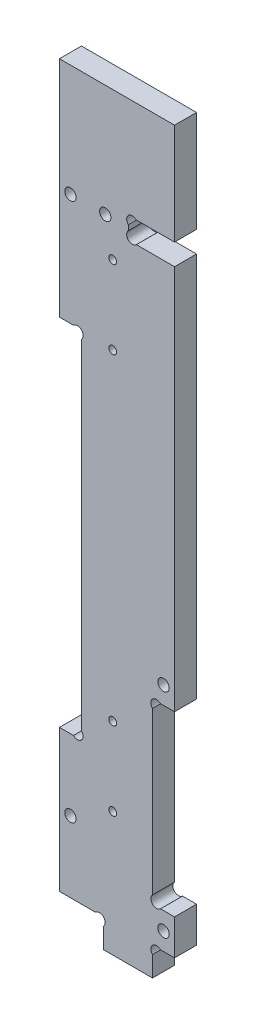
SolidWorks part; units mm, degrees
ref_plane "Face" through (0, 0, 0) normal (0, 0, 1) x (1, 0, 0)
ref_plane "Dessus" through (0, 0, 0) normal (0, 1, 0) x (1, 0, 0)
ref_plane "Droite" through (0, 0, 0) normal (1, 0, 0) x (0, 0, -1)
sketch "Esquisse1" plane through (0, 0, 0) normal (0, 0, 1) x (1, 0, 0)
  line L0 (6.2, 50) -> (-11.8335, 68.0335) construction
  line L1 (11.2604, 30) -> (-9.448, 30) construction
  line L2 (0, 150) -> (0, 213)
  line L3 (26.2, 10) -> (39.7264, -3.5264) construction
  line L4 (3.1, 201.4419) -> (3.1, 25.1877) construction
  line L5 (0, -19.1604) -> (0, 238.3794) construction
  line L6 (-28.0225, 0) -> (100.2626, 0) construction
  line L7 (-28.0225, 10) -> (93.2855, 10) construction
  line L8 (-20.6308, 50) -> (11.2604, 50) construction
  line L9 (-28.0225, 100) -> (78.1465, 100) construction
  line L10 (6.2, 16.3743) -> (6.2, 159.4009) construction
  line L11 (19.3, -19.1604) -> (19.3, 23.4146) construction
  line L12 (3.9373, 50) -> (0, 50)
  line L13 (0, 50) -> (0, 10)
  line L14 (26.2, 7.7373) -> (26.2, 2)
  line L15 (12.4, 7.7373) -> (12.4, 2)
  line L16 (0, 213) -> (32.4, 213)
  line L17 (3.9373, 150) -> (0, 150)
  line L18 (6.2, 147.7373) -> (6.2, 52.2627)
  line L19 (9.7007, 80) -> (78.1465, 80) construction
  line L20 (-28.0225, 213) -> (100.2626, 213) construction
  line L21 (9.7007, 45) -> (52.8201, 45) construction
  line L22 (0, 10) -> (10.1373, 10)
  line L23 (32.4, 238.3794) -> (32.4, -19.1604) construction
  line L24 (26.2, 15.0314) -> (26.2, 93.1408) construction
  line L26 (29.3, 89.8811) -> (29.3, 71.2) construction
  line L27 (26.2, 20) -> (38.2477, 32.0477) construction
  line L28 (52.8201, 70) -> (23.2931, 70) construction
  line L29 (17.5561, 75) -> (52.8201, 75) construction
  line L30 (28.4627, 10) -> (32.4, 10)
  line L31 (32.4, 10) -> (32.4, 20)
  line L32 (32.4, 20) -> (28.4627, 20)
  line L33 (26.2, 22.2627) -> (26.2, 67.7373)
  line L34 (28.4627, 70) -> (32.4, 70)
  line L35 (32.4, 70) -> (32.4, 178.5)
  line L36 (0, 181.5) -> (17.5561, 181.5) construction
  line L37 (26.2, -19.1604) -> (26.2, 13.5781) construction
  line L38 (15, 229.5918) -> (15, -34.5185) construction
  line L39 (8.9701, 37) -> (93.2855, 37) construction
  line L40 (8.9701, 59) -> (93.2855, 59) construction
  line L41 (8.9701, 149.5) -> (93.2855, 149.5) construction
  line L42 (9.7007, 184.5) -> (38.2477, 184.5) construction
  line L43 (93.2855, 171.5) -> (9.7007, 171.5) construction
  line L44 (9.7007, 178.5) -> (38.2477, 178.5) construction
  line L45 (19.4, 204.8636) -> (19.4, 164.6352) construction
  line L46 (12.9, 204.8636) -> (12.9, 164.6352) construction
  line L47 (19.4, 184.5) -> (30.094, 173.806) construction
  line L48 (19.4, 182.2373) -> (19.4, 180.7627)
  line L49 (21.6627, 184.5) -> (32.4, 184.5)
  line L50 (21.6627, 178.5) -> (32.4, 178.5)
  line L51 (32.4, 184.5) -> (32.4, 213)
  line L52 (-4.4955, 2) -> (60.3452, 2) construction
  line L53 (12.4, 2) -> (26.2, 2)
  circle A0 centre (3.1, 30) radius 1.6
  arc A1 (3.9373, 50) -> (6.2, 52.2627) centre (5.0686, 51.1314) ccw
  arc A2 (28.4627, 10) -> (26.2, 7.7373) centre (27.3314, 8.8686) ccw
  arc A3 (3.9373, 150) -> (6.2, 147.7373) centre (5.0686, 148.8686) cw
  circle A4 centre (3.1, 181.5) radius 1.6
  arc A5 (10.1373, 10) -> (12.4, 7.7373) centre (11.2686, 8.8686) cw
  arc A6 (26.2, 22.2627) -> (28.4627, 20) centre (27.3314, 21.1314) ccw
  arc A7 (26.2, 67.7373) -> (28.4627, 70) centre (27.3314, 68.8686) cw
  circle A8 centre (29.3, 75) radius 1.6
  circle A9 centre (29.3, 15) radius 1.6
  circle A10 centre (15, 37) radius 1.1
  circle A11 centre (15, 59) radius 1.1
  circle A12 centre (15, 149.5) radius 1.1
  circle A13 centre (15, 171.5) radius 1.1
  circle A14 centre (12.9, 181.5) radius 1.6
  arc A15 (21.6627, 184.5) -> (19.4, 182.2373) centre (20.5314, 183.3686) ccw
  arc A16 (21.6627, 178.5) -> (19.4, 180.7627) centre (20.5314, 179.6314) cw
  dimension "D7" = 45
  dimension "D8" = 3.1
  dimension "D9" = 20
  dimension "D13" = 32.4
  dimension "D10" = 70
  dimension "D16" = 5
  dimension "D17" = 6
  dimension "D18" = 45
  dimension "D19" = 15
  dimension "D22" = 90.5
  dimension "D24" = 3
  dimension "D27" = 8
  dimension "D2" = 6.2
  dimension "D3" = 10
  dimension "D4" = 40
  dimension "D5" = 90
  dimension "D6" = 6.9
  dimension "D11" = 27
  dimension "D12" = 203
  dimension "D14" = 6.2
  dimension "D15" = 3.1
  dimension "D20" = 13
  dimension "D21" = 22
  dimension "D23" = 22
  dimension "D25" = 6.5
  dimension "D26" = 45
extrude "Extrusion1" add sketch "Esquisse1" along normal blind 6.2
